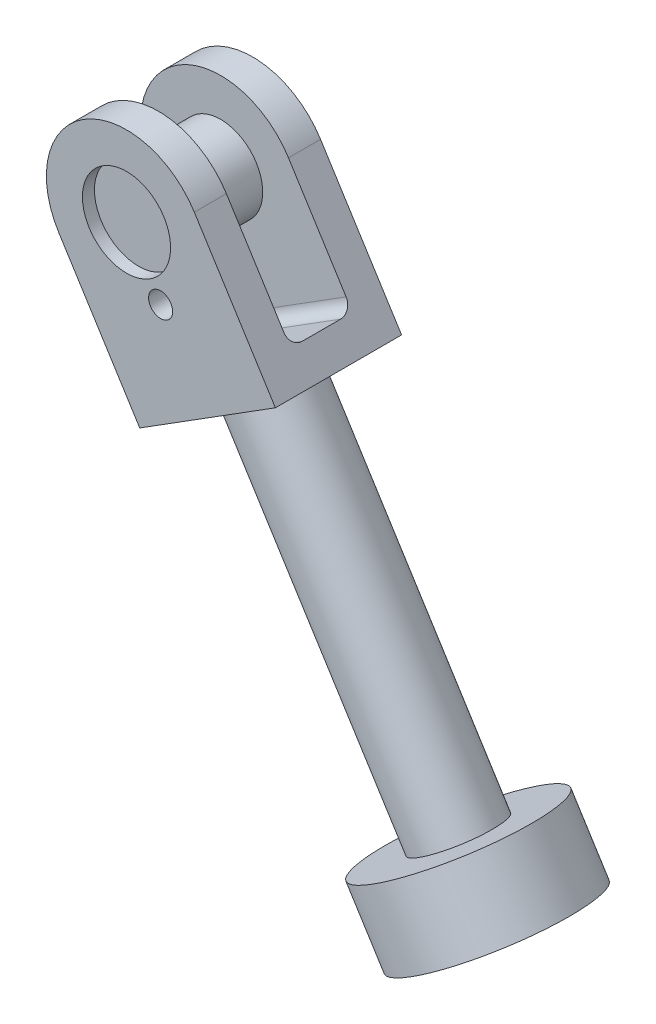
SolidWorks part; units mm, degrees
ref_plane "Front Plane" through (0, 0, 0) normal (0, 0, 1) x (1, 0, 0)
ref_plane "Top Plane" through (0, 0, 0) normal (0, 1, 0) x (1, 0, 0)
ref_plane "Right Plane" through (0, 0, 0) normal (1, 0, 0) x (0, 0, -1)
sketch "Sketch1" plane through (0, 0, 0) normal (0, 0, 1) x (1, 0, 0)
  circle A2 centre (-86, 190.5) radius 12.5 construction
  circle A3 centre (30.0522, 5.9464) radius 12.5 construction
  circle A4 centre (-86, 190.5) radius 11
  circle A5 centre (30.0522, 5.9464) radius 11
  dimension "D2" = 22
  dimension "D1" = 22
extrude "Boss-Extrude1" add sketch "Sketch1" along normal mid plane 15.5
sketch "Sketch2" plane through (0, 0, -7.75) normal (0, 0, -1) x (-1, 0, 0)
  line L0 (-30.0522, 5.9464) -> (86, 190.5) construction
  line L1 (-30.0522, 5.9464) -> (86, 190.5) construction
  line L2 (-46.983, 16.593) -> (69.0692, 201.1465)
  line L3 (-13.1214, -4.7001) -> (102.9308, 179.8535)
  arc A0 (-46.983, 16.593) -> (-13.1214, -4.7001) centre (-30.0522, 5.9464) ccw
  arc A1 (102.9308, 179.8535) -> (69.0692, 201.1465) centre (86, 190.5) ccw
  point P4 (27.9739, 98.2232)
  dimension "D1" = 20
extrude "Boss-Extrude2" add sketch "Sketch2" along normal blind 8
sketch "Sketch3" plane through (0, 0, 7.75) normal (0, 0, 1) x (1, 0, 0)
  line L2 (46.983, 16.593) -> (-69.0692, 201.1465)
  line L3 (-102.9308, 179.8535) -> (13.1214, -4.7001)
  line L4 (46.983, 16.593) -> (-69.0692, 201.1465)
  line L5 (-102.9308, 179.8535) -> (13.1214, -4.7001)
  arc A2 (-69.0692, 201.1465) -> (-102.9308, 179.8535) centre (-86, 190.5) ccw
  arc A3 (13.1214, -4.7001) -> (46.983, 16.593) centre (30.0522, 5.9464) ccw
  arc A4 (-69.0692, 201.1465) -> (-102.9308, 179.8535) centre (-86, 190.5) ccw
  arc A5 (13.1214, -4.7001) -> (46.983, 16.593) centre (30.0522, 5.9464) ccw
  dimension "D1" = 0
extrude "Boss-Extrude3" add sketch "Sketch3" along normal blind 8
sketch "Sketch4" plane through (0, 0, 15.75) normal (0, 0, 1) x (1, 0, 0)
  line L0 (-53.0994, 175.7503) -> (-86.961, 154.4573)
  line L1 (46.983, 16.593) -> (-69.0692, 201.1465) construction
  line L2 (-102.9308, 179.8535) -> (13.1214, -4.7001) construction
  line L3 (-86.961, 154.4573) -> (-2.8484, 20.6961)
  line L4 (-2.8484, 20.6961) -> (31.0132, 41.9892)
  line L5 (31.0132, 41.9892) -> (-53.0994, 175.7503)
  dimension "D1" = 30
  dimension "D2" = 30
extrude "Cut-Extrude1" cut sketch "Sketch4" against normal through all
sketch "Sketch5" plane through (-94.2461, 149.8762, 0) normal (0.5323, -0.8465, 0) x (0.8465, 0.5323, 0)
  line L1 (48.6058, -15.75) -> (8.6058, -15.75)
  line L2 (48.6058, -15.75) -> (48.6058, 15.75)
  line L3 (48.6058, 15.75) -> (8.6058, 15.75)
  line L4 (8.6058, -15.75) -> (8.6058, 15.75)
extrude "Boss-Extrude4" add sketch "Sketch5" along normal blind 8
sketch "Sketch6" plane through (-10.1335, 16.115, 0) normal (-0.5323, 0.8465, 0) x (0.8465, 0.5323, 0)
  line L1 (48.6058, 15.75) -> (8.6058, 15.75)
  line L2 (48.6058, 15.75) -> (48.6058, -15.75)
  line L3 (48.6058, -15.75) -> (8.6058, -15.75)
  line L4 (8.6058, 15.75) -> (8.6058, -15.75)
extrude "Boss-Extrude5" add sketch "Sketch6" along normal blind 8
sketch "Sketch7" plane through (-14.3922, 22.8873, 0) normal (-0.5323, 0.8465, 0) x (0.8465, 0.5323, 0)
  line L0 (8.6058, 15.75) -> (48.6058, -15.75) construction
  circle A0 centre (28.6058, 0) radius 27.5
  dimension "D1" = 55
extrude "Boss-Extrude6" add sketch "Sketch7" along normal blind 8
sketch "Sketch8" plane through (-18.6508, 29.6596, 0) normal (-0.5323, 0.8465, 0) x (0.8465, 0.5323, 0)
  circle A0 centre (28.6058, 0) radius 21.5
  circle A1 centre (28.6058, 0) radius 27.5
  circle A2 centre (28.6058, 0) radius 27.5
  dimension "D1" = 0
  dimension "D2" = 6
extrude "Boss-Extrude7" add sketch "Sketch8" along normal blind 85
sketch "Sketch9" plane through (-89.9875, 143.1039, 0) normal (0.5323, -0.8465, 0) x (0.8465, 0.5323, 0)
  line L0 (8.6058, 15.75) -> (48.6058, -15.75) construction
  circle A0 centre (28.6058, 0) radius 10
  dimension "D1" = 20
extrude "Boss-Extrude8" add sketch "Sketch9" along normal blind 100
sketch "Sketch10" plane through (-63.8985, 101.6155, 0) normal (-0.5323, 0.8465, 0) x (0.8465, 0.5323, 0)
  circle A0 centre (28.6058, 0) radius 10.125
  circle A1 centre (28.6058, 0) radius 27.5
  circle A2 centre (28.6058, 0) radius 27.5
  dimension "D2" = 20.25
  dimension "D1" = 0
extrude "Boss-Extrude9" add sketch "Sketch10" along normal blind 6
sketch "Sketch11" plane through (-36.7549, 58.45, 0) normal (0.5323, -0.8465, 0) x (0.8465, 0.5323, 0)
  circle A0 centre (28.6058, 0) radius 21.5
  circle A1 centre (28.6058, 0) radius 21.5
extrude "Boss-Extrude10" add sketch "Sketch11" along normal blind 6 and the other way blind 12 separate body
combine bodies "Combine1" operation type add bodies to combine 113 111
delete or keep bodies "Body-Delete/Keep 1" type delete bodies bodies 112
sketch "Sketch12" plane through (0, 0, 7.75) normal (0, 0, -1) x (-1, 0, 0)
  circle A0 centre (86, 190.5) radius 11 construction
  circle A1 centre (86, 190.5) radius 11
extrude "Cut-Extrude2" cut sketch "Sketch12" against normal through all and the other way through all
sketch "Sketch13" plane through (0, 0, 15.75) normal (0, 0, 1) x (1, 0, 0)
  line L0 (-86, 190.5) -> (-77.4828, 176.9554) construction
  line L1 (-48.8408, 168.978) -> (-69.0692, 201.1465) construction
  circle A0 centre (-77.4828, 176.9554) radius 3
  dimension "D1" = 6
  dimension "D2" = 16
extrude "Cut-Extrude3" cut sketch "Sketch13" against normal up to next
fillet "Fillet1" radius 3 2 edges at (-70.0302, 165.1038, 7.75) (-70.0302, 165.1038, -7.75)
sketch "Sketch14" plane through (0, 0, -7.75) normal (0, 0, 1) x (1, 0, 0)
  circle A0 centre (-86, 190.5) radius 11 construction
  circle A1 centre (-86, 190.5) radius 11
  circle A2 centre (-86, 190.5) radius 10.5
  dimension "D1" = 21
extrude "Boss-Extrude11" add sketch "Sketch14" against normal blind 5
sketch "Sketch15" plane through (0, 0, 7.75) normal (0, 0, -1) x (-1, 0, 0)
  circle A1 centre (86, 190.5) radius 10.5
  circle A2 centre (86, 190.5) radius 10.5
  circle A3 centre (86, 190.5) radius 11
  circle A4 centre (86, 190.5) radius 11
  dimension "D1" = 0
  dimension "D2" = 0
extrude "Boss-Extrude12" add sketch "Sketch15" against normal blind 5
sketch "Sketch16" plane through (0, 0, -12.75) normal (0, 0, -1) x (-1, 0, 0)
  circle A0 centre (86, 190.5) radius 10.5 construction
  circle A1 centre (86, 190.5) radius 10.5
extrude "Boss-Extrude13" add sketch "Sketch16" against normal up to surface (25.5 mm away)
